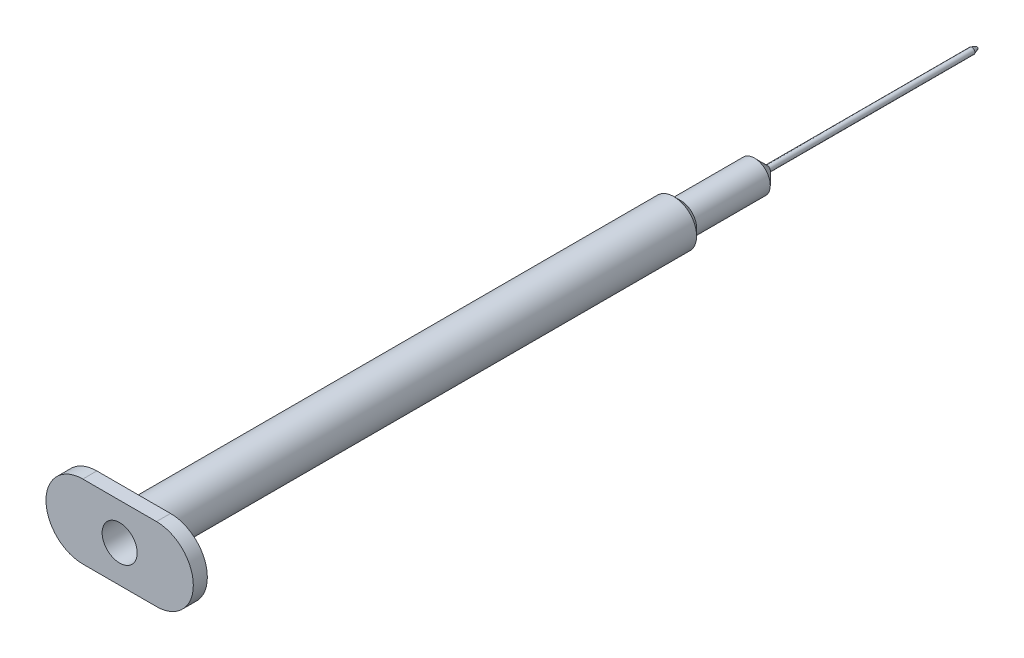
SolidWorks part; units mm, degrees
ref_plane "Ebene vorne" through (0, 0, 0) normal (0, 0, 1) x (1, 0, 0)
ref_plane "Ebene oben" through (0, 0, 0) normal (0, 1, 0) x (1, 0, 0)
ref_plane "Ebene rechts" through (0, 0, 0) normal (1, 0, 0) x (0, 0, -1)
sketch "Skizze1" plane through (0, 0, 0) normal (0, 0, 1) x (1, 0, 0)
  circle A0 centre (0, 0) radius 3.25
  circle A1 centre (0, 0) radius 2.5
  dimension "D1" = 6.5
  dimension "D2" = 5
extrude "Aufsatz-Linear austragen1" add sketch "Skizze1" against normal blind 75
sketch "Skizze2" plane through (0, 0, 0) normal (0, 1, 0) x (1, 0, 0)
  line L0 (0, 120.5) -> (0, -5.8189) construction
  line L1 (0, 75) -> (3.25, 75)
  line L2 (3.25, 75) -> (-3.25, 75) construction
  line L3 (3.25, 0) -> (3.25, 75) construction
  line L4 (3.25, 75) -> (3.25, 78)
  line L5 (3.25, 78) -> (2.25, 78)
  line L6 (2.25, 78) -> (2.25, 90.5)
  line L7 (2.25, 90.5) -> (0.425, 90.5)
  line L8 (0.425, 90.5) -> (0.425, 120.5)
  line L9 (0.425, 120.5) -> (0, 120.5)
  line L10 (0, 75) -> (0, 120.5)
  dimension "D1" = 4.5
  dimension "D2" = 0.85
  dimension "D3" = 12.5
  dimension "D4" = 3
  dimension "D5" = 30
revolve "Rotation1" add sketch "Skizze2" angle 360 about L0
chamfer "Fase1" distance 2 angle 45 1 edges at (-2.25, 0, -90.5)
chamfer "Fase2" distance 1 angle 45 1 edges at (-3.25, 0, -78)
sketch "Skizze3" plane through (0, 0, 0) normal (0, 0, 1) x (1, 0, 0)
  line L0 (-4.4255, 0) -> (7.8734, 0) construction
  line L1 (-5.25, 0) -> (5.25, 0) construction
  line L2 (-5.25, 5.25) -> (5.25, 5.25)
  line L3 (-5.25, -5.25) -> (5.25, -5.25)
  arc A0 (-5.25, 5.25) -> (-5.25, -5.25) centre (-5.25, 0) ccw
  arc A1 (5.25, -5.25) -> (5.25, 5.25) centre (5.25, 0) ccw
  point P5 (0, 0)
  dimension "D2" = 21
  dimension "D3" = 10.5
  dimension "D1" = 10.5
extrude "Aufsatz-Linear austragen2" add sketch "Skizze3" along normal blind 2
sketch "Skizze4" plane through (0, 0, 2) normal (0, 0, 1) x (1, 0, 0)
  circle A0 centre (0, 0) radius 2.5
  dimension "D1" = 5
extrude "Schnitt-Linear austragen1" cut sketch "Skizze4" against normal blind 3
sketch "Skizze5" plane through (0, 0, 0) normal (0, 0, -1) x (-1, 0, 0)
  circle A0 centre (0, 0) radius 0.175
  dimension "D1" = 0.35
extrude "Schnitt-Linear austragen3" cut sketch "Skizze5" along normal through all
chamfer "Fase3" distance 1 angle 20 1 edges at (-0.425, 0, -120.5)
